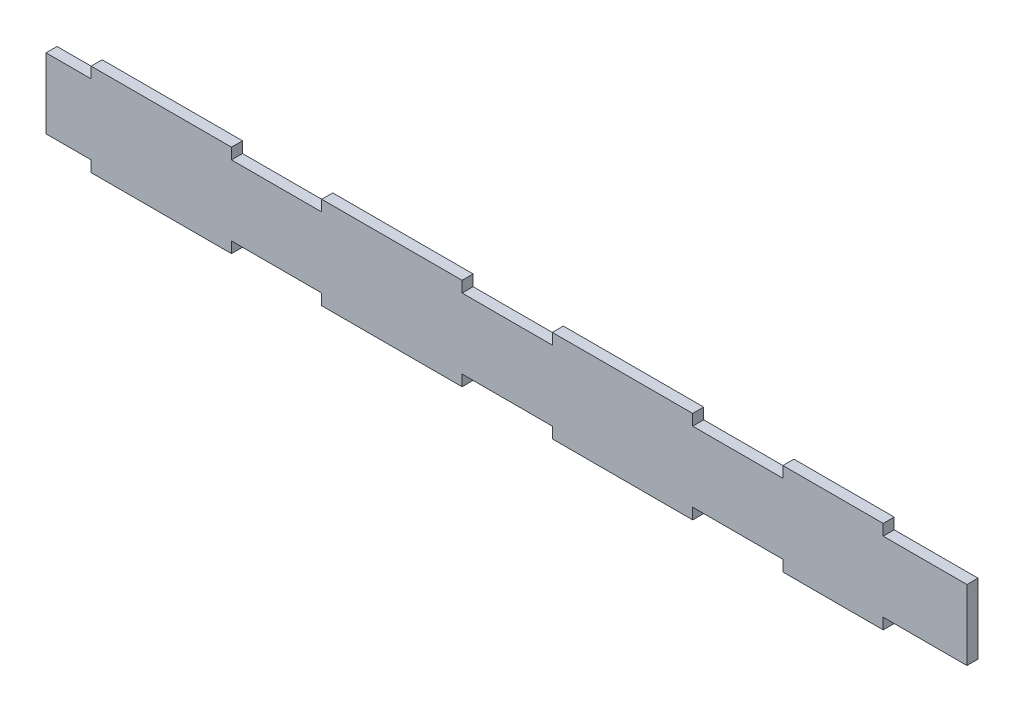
SolidWorks part; units mm, degrees
ref_plane "Front Plane" through (0, 0, 0) normal (0, 0, 1) x (1, 0, 0)
ref_plane "Top Plane" through (0, 0, 0) normal (0, 1, 0) x (1, 0, 0)
ref_plane "Right Plane" through (0, 0, 0) normal (1, 0, 0) x (0, 0, -1)
sketch "Sketch1" plane through (0, 0, 0) normal (0, 0, 1) x (1, 0, 0)
  line L0 (136.6682, 49.9484) -> (186.6682, 49.9484)
  line L5 (186.6682, 49.9484) -> (186.6682, 55.4484)
  line L6 (186.6682, 55.4484) -> (206.6682, 55.4484)
  line L7 (136.6682, 95.9484) -> (186.6682, 95.9484)
  line L8 (186.6682, 95.9484) -> (186.6682, 90.4484)
  line L9 (186.6682, 90.4484) -> (206.6682, 90.4484)
  line L37 (-230.8318, 55.4484) -> (-230.8318, 90.4484)
  line L38 (-230.8318, 90.4484) -> (-208.3318, 90.4484)
  line L39 (-208.3318, 90.4484) -> (-208.3318, 95.9484)
  line L40 (-208.3318, 95.9484) -> (-138.3318, 95.9484)
  line L41 (-138.3318, 95.9484) -> (-138.3318, 90.4484)
  line L42 (-138.3318, 90.4484) -> (-93.3318, 90.4484)
  line L43 (-93.3318, 90.4484) -> (-93.3318, 95.9484)
  line L44 (-93.3318, 95.9484) -> (-23.3318, 95.9484)
  line L45 (-23.3318, 95.9484) -> (-23.3318, 90.4484)
  line L46 (-23.3318, 90.4484) -> (21.6682, 90.4484)
  line L47 (21.6682, 90.4484) -> (21.6682, 95.9484)
  line L48 (21.6682, 95.9484) -> (91.6682, 95.9484)
  line L49 (91.6682, 95.9484) -> (91.6682, 90.4484)
  line L50 (91.6682, 90.4484) -> (136.6682, 90.4484)
  line L51 (136.6682, 90.4484) -> (136.6682, 95.9484)
  line L54 (206.6682, 90.4484) -> (228.45, 90.4484)
  line L55 (228.45, 90.4484) -> (228.45, 55.4484)
  line L56 (228.45, 55.4484) -> (206.6682, 55.4484)
  line L59 (136.6682, 49.9484) -> (136.6682, 55.4484)
  line L60 (136.6682, 55.4484) -> (91.6682, 55.4484)
  line L61 (91.6682, 55.4484) -> (91.6682, 49.9484)
  line L62 (91.6682, 49.9484) -> (21.6682, 49.9484)
  line L63 (21.6682, 49.9484) -> (21.6682, 55.4484)
  line L64 (21.6682, 55.4484) -> (-23.3318, 55.4484)
  line L65 (-23.3318, 55.4484) -> (-23.3318, 49.9484)
  line L66 (-23.3318, 49.9484) -> (-93.3318, 49.9484)
  line L67 (-93.3318, 49.9484) -> (-93.3318, 55.4484)
  line L68 (-93.3318, 55.4484) -> (-138.3318, 55.4484)
  line L69 (-138.3318, 55.4484) -> (-138.3318, 49.9484)
  line L70 (-138.3318, 49.9484) -> (-208.3318, 49.9484)
  line L71 (-208.3318, 49.9484) -> (-208.3318, 55.4484)
  line L72 (-208.3318, 55.4484) -> (-230.8318, 55.4484)
  dimension "D1" = 35
extrude "Boss-Extrude1" add sketch "Sketch1" along normal blind 5.5
